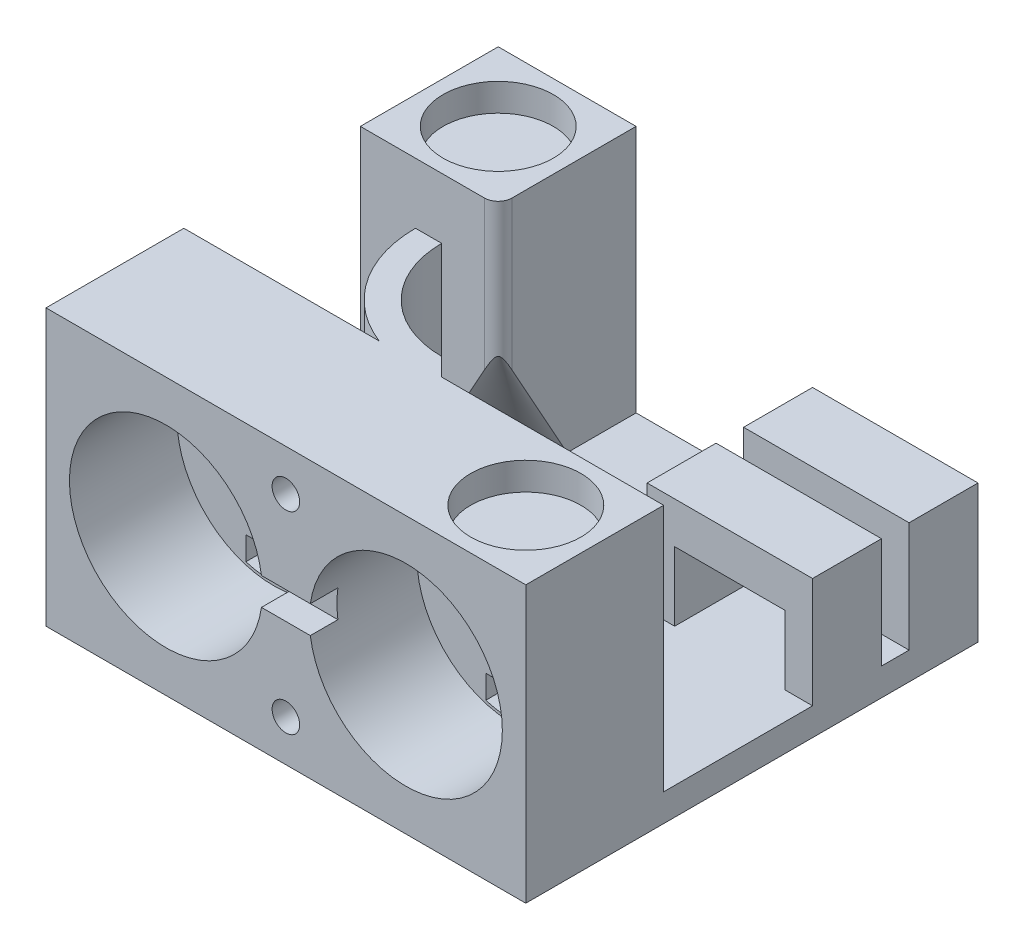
SolidWorks part; units mm, degrees
ref_plane "Front Plane" through (0, 0, 0) normal (0, 0, 1) x (1, 0, 0)
ref_plane "Top Plane" through (0, 0, 0) normal (0, 1, 0) x (1, 0, 0)
ref_plane "Right Plane" through (0, 0, 0) normal (1, 0, 0) x (0, 0, -1)
sketch "Sketch1" plane through (0, 0, 0) normal (0, 1, 0) x (1, 0, 0)
  line L1 (-8.7, -8.7) -> (8.7, -8.7)
  line L2 (-8.7, -8.7) -> (-8.7, 8.7)
  line L3 (-8.7, 8.7) -> (8.7, 8.7)
  line L4 (8.7, -8.7) -> (8.7, 8.7)
  line L5 (-8.7, -8.7) -> (8.7, 8.7) construction
  line L6 (-8.7, 8.7) -> (8.7, -8.7) construction
  point P0 (0, 0)
  dimension "D1" = 17.4
extrude "Boss-Extrude1" add sketch "Sketch1" along normal blind 1
ref_plane "Plane1" through (0, 0, 8.7) normal (0, 0, 1) x (1, 0, 0)
sketch "Sketch4" plane through (0, 0, 8.7) normal (0, 0, 1) x (1, 0, 0)
  line L0 (0, -1000) -> (0, 49000) construction
  line L2 (-8.7, 1) -> (8.7, 1)
  line L3 (-8.7, 1) -> (-8.7, 10)
  line L4 (-8.7, 10) -> (8.7, 10)
  line L5 (8.7, 1) -> (8.7, 10)
  dimension "D1" = 9
extrude "Boss-Extrude3" add sketch "Sketch4" against normal blind 6
sketch "Sketch7" plane through (8.7, 0, 0) normal (1, 0, 0) x (0, 0, -1)
  line L0 (-8.7, 4.4) -> (-8.7, -4.4) construction
  line L1 (-8.7, 0) -> (-7.7, 0)
  line L2 (-8.7, 0) -> (-8.7, 10)
  line L3 (-8.7, 10) -> (-7.7, 10)
  line L4 (-7.7, 0) -> (-7.7, 10)
  line L5 (-2.7, 10) -> (-8.7, 10) construction
  dimension "D1" = 1
  dimension "D2" = 10
extrude "Cut-Extrude3" cut sketch "Sketch7" against normal through all both and the other way through all
sketch "Sketch11" plane through (0, 0, 7.7) normal (0, 0, 1) x (1, 0, 0)
  line L0 (0, -1000) -> (0, 49000) construction
  line L1 (8.7, 10) -> (8.7, 0) construction
  line L2 (-1000, 5) -> (49000, 5) construction
  circle A0 centre (4.35, 5) radius 3.5
  circle A1 centre (-4.35, 5) radius 3.5
  point P6 (8.7, 5)
  dimension "D1" = 7
  dimension "D2" = 8.7
  dimension "D3" = 4.35
extrude "Cut-Extrude7" cut sketch "Sketch11" against normal blind 3.9
sketch "Sketch13" plane through (0, 0, 7.7) normal (0, 0, 1) x (1, 0, 0)
  line L0 (0, -1000) -> (0, 49000) construction
  line L1 (-999.15, 5) -> (49000.85, 5) construction
  line L2 (8.7, 10) -> (8.7, 0) construction
  line L3 (5.35, 1.7504) -> (5.35, 2.6)
  line L4 (-4.35, -998.5065) -> (-4.35, 49001.4935) construction
  line L5 (-8.7, 0) -> (-8.7, 10) construction
  line L6 (-5.35, 1.7504) -> (-5.35, 2.6)
  line L7 (-5.35, 2.6) -> (-3.35, 2.6)
  line L8 (-3.35, 2.6) -> (-3.35, 1.7504)
  line L9 (5.35, 2.6) -> (3.35, 2.6)
  line L10 (3.35, 2.6) -> (3.35, 1.7504)
  arc A0 (3.35, 1.7504) -> (5.35, 1.7504) centre (4.35, 5) ccw
  circle A3 centre (-4.35, 5) radius 3.4 construction
  arc A4 (-3.35, 1.7504) -> (-5.35, 1.7504) centre (-4.35, 5) cw
  point P7 (8.7, 5)
  point P22 (-4.35, 2.6)
  dimension "D1" = 6.8
  dimension "D2" = 4.35
  dimension "D3" = 1
  dimension "D4" = 2.4
extrude "Cut-Extrude8" cut sketch "Sketch13" against normal up to next
sketch "Sketch14" plane through (0, 0, 7.7) normal (0, 0, 1) x (1, 0, 0)
  line L0 (-999.15, 5) -> (49000.85, 5) construction
  line L2 (-0.8859, 4.5) -> (0.8859, 4.5)
  line L3 (-0.8859, 4.5) -> (-0.8859, 5.5)
  line L4 (-0.8859, 5.5) -> (0.8859, 5.5)
  line L5 (0.8859, 4.5) -> (0.8859, 5.5)
  line L6 (-0.8859, 4.5) -> (0.8859, 5.5) construction
  line L7 (-0.8859, 5.5) -> (0.8859, 4.5) construction
  circle A2 centre (4.35, 5) radius 3.5 construction
  circle A3 centre (-4.35, 5) radius 3.5 construction
  point P1 (0, 5)
  dimension "D1" = 5
  dimension "D2" = 1
extrude "Cut-Extrude9" cut sketch "Sketch14" against normal blind 1
sketch "Sketch15" plane through (0, 0, 7.7) normal (0, 0, 1) x (1, 0, 0)
  line L0 (0, -1000) -> (0, 49000) construction
  line L1 (-1000, 1.5) -> (49000, 1.5) construction
  line L2 (-1000, 8.5) -> (49000, 8.5) construction
  line L3 (9.02, 0) -> (-9.02, 0) construction
  line L4 (-8.7, 10) -> (8.7, 10) construction
  circle A0 centre (0, 8.5) radius 0.5
  circle A1 centre (0, 1.5) radius 0.5
  dimension "D3" = 1
  dimension "D1" = 1.5
  dimension "D2" = 1.5
extrude "Cut-Extrude11" cut sketch "Sketch15" against normal up to next
sketch "Sketch16" plane through (0, 1, 0) normal (0, 1, 0) x (1, 0, 0)
  line L0 (0, -1000) -> (0, 49000) construction
  circle A0 centre (0, 1.5) radius 2.9
  dimension "D1" = 5.8
  dimension "D2" = 1.5
extrude "Cut-Extrude12" cut sketch "Sketch16" against normal up to next
sketch "Sketch17" plane through (0, 1, 0) normal (0, 1, 0) x (1, 0, 0)
  line L0 (0, -1000) -> (0, 49000) construction
  line L1 (-1000, 0) -> (49000, 0) construction
  line L4 (-8.7, 8.7) -> (-3.7, 8.7)
  line L5 (-8.7, 8.7) -> (-8.7, 3.7)
  line L6 (-8.7, 3.7) -> (-3.7, 3.7)
  line L7 (-3.7, 8.7) -> (-3.7, 3.7)
  dimension "D1" = 5
  dimension "D2" = 5
extrude "Boss-Extrude4" add sketch "Sketch17" along normal up to surface (9 mm away)
sketch "Sketch19" plane through (-3.7, 0, 0) normal (1, 0, 0) x (0, 0, -1)
  line L0 (3.7, 5.5) -> (6.2, 1)
  line L1 (3.7, 10) -> (3.7, 1) construction
  line L2 (3.7, 1) -> (8.7, 1) construction
  line L3 (6.2, 1) -> (3.7, 1)
  line L4 (3.7, 1) -> (3.7, 5.5)
  line L5 (3.7, -993.6268) -> (3.7, 49006.3732) construction
  dimension "D1" = 3.7
revolve "Cut-Revolve1" cut sketch "Sketch19" angle 90 about L5
fillet "Fillet1" radius 0.5 1 edges at (-3.7, 7.75, -3.7)
sketch "Sketch20" plane through (0, 1, 0) normal (0, 1, 0) x (1, 0, 0)
  line L0 (0, -1000) -> (0, 49000) construction
  line L1 (-1000, 0) -> (49000, 0) construction
  line L4 (8.7, 8.7) -> (2.6996, 8.7)
  line L5 (8.7, 8.7) -> (8.7, 2.7)
  line L6 (8.7, 2.7) -> (2.6996, 2.7)
  line L7 (2.6996, 8.7) -> (2.6996, 2.7)
  dimension "D1" = 6
  dimension "D2" = 6.0004
extrude "Boss-Extrude5" add sketch "Sketch20" along normal up to surface (9 mm away)
sketch "Sketch21" plane through (8.7, 0, 0) normal (1, 0, 0) x (0, 0, -1)
  line L0 (8.7, 10) -> (8.7, 0) construction
  line L1 (2.7, 10) -> (8.7, 10)
  line L2 (2.7, 10) -> (2.7, 5)
  line L3 (2.7, 5) -> (8.7, 5)
  line L4 (8.7, 10) -> (8.7, 5)
  dimension "D1" = 5
extrude "Cut-Extrude13" cut sketch "Sketch21" against normal up to next
sketch "Sketch22" plane through (0, 5, 0) normal (0, 1, 0) x (1, 0, 0)
  line L0 (-997.3004, 5.7) -> (49002.6996, 5.7) construction
  line L1 (2.6996, 8.7) -> (2.6996, 2.7) construction
  line L2 (8.7, 2.7) -> (8.7, 8.7) construction
  line L3 (2.6996, 5.2) -> (8.7, 5.2)
  line L4 (2.6996, 5.2) -> (2.6996, 6.2)
  line L5 (2.6996, 6.2) -> (8.7, 6.2)
  line L6 (8.7, 5.2) -> (8.7, 6.2)
  line L7 (2.6996, 5.2) -> (8.7, 6.2) construction
  line L8 (2.6996, 6.2) -> (8.7, 5.2) construction
  line L9 (2.6996, 2.7) -> (8.7, 2.7) construction
  point P1 (5.6998, 5.7)
  point P5 (2.6996, 5.7)
  point P15 (5.6998, 2.7)
  dimension "D1" = 1
extrude "Cut-Extrude14" cut sketch "Sketch22" against normal up to surface (4 mm away)
sketch "Sketch23" plane through (0, 0, -8.7) normal (0, 0, -1) x (-1, 0, 0)
  line L0 (-1001.9182, 1) -> (48998.0818, 1) construction
  line L2 (-8.7, 5) -> (-8.7, 0) construction
  line L3 (-7.7, 1) -> (-3.6996, 1)
  line L4 (-7.7, 1) -> (-7.7, 3.5)
  line L5 (-7.7, 3.5) -> (-3.6996, 3.5)
  line L6 (-3.6996, 1) -> (-3.6996, 3.5)
  line L7 (-2.6996, 5) -> (-2.6996, 1) construction
  line L8 (-2.6996, 5) -> (-8.7, 5) construction
  dimension "D1" = 1
  dimension "D2" = 1
  dimension "D3" = 1
  dimension "D4" = 1.5
extrude "Cut-Extrude15" cut sketch "Sketch23" against normal up to surface (6 mm away)
sketch "Sketch24" plane through (0, 1, 0) normal (0, 1, 0) x (1, 0, 0)
  line L0 (0, -1000) -> (0, 49000) construction
  line L2 (-1000, 1.5) -> (49000, 1.5) construction
  line L3 (-4.5, 1.5) -> (-3.55, 1.5)
  line L4 (0, -2.05) -> (0, -3)
  line L5 (0, -2.05) -> (0.8659, -2.9159)
  circle A0 centre (0, 1.5) radius 3.55
  circle A1 centre (0, 1.5) radius 2.9 construction
  circle A2 centre (0, 1.5) radius 4.5
  dimension "D1" = 7.1
  dimension "D2" = 9
  dimension "D3" = 45
extrude "Boss-Extrude6" add sketch "Sketch24" along normal up to surface (9 mm away) contours L3 A2 L4 A0 M10 | L5 L4 M11
sketch "Sketch25" plane through (0, 10, 0) normal (0, 1, 0) x (1, 0, 0)
  line L0 (-6.2, -996.3) -> (-6.2, 49003.7) construction
  line L1 (-1008.7, 6.2) -> (48991.3, 6.2) construction
  line L2 (-8.7, 8.7) -> (-8.7, 3.7) construction
  line L3 (-991.3, -5.2) -> (49008.7, -5.2) construction
  line L4 (8.7, -2.7) -> (8.7, -7.7) construction
  line L5 (6.2, -1002.7) -> (6.2, 48997.3) construction
  circle A0 centre (-6.2, 6.2) radius 2
  circle A1 centre (6.2, -5.2) radius 2
  point P8 (-8.7, 6.2)
  point P15 (8.7, -5.2)
  dimension "D1" = 4
  dimension "4" = 4
  dimension "D2" = 2.5
extrude "Cut-Extrude16" cut sketch "Sketch25" against normal blind 1
